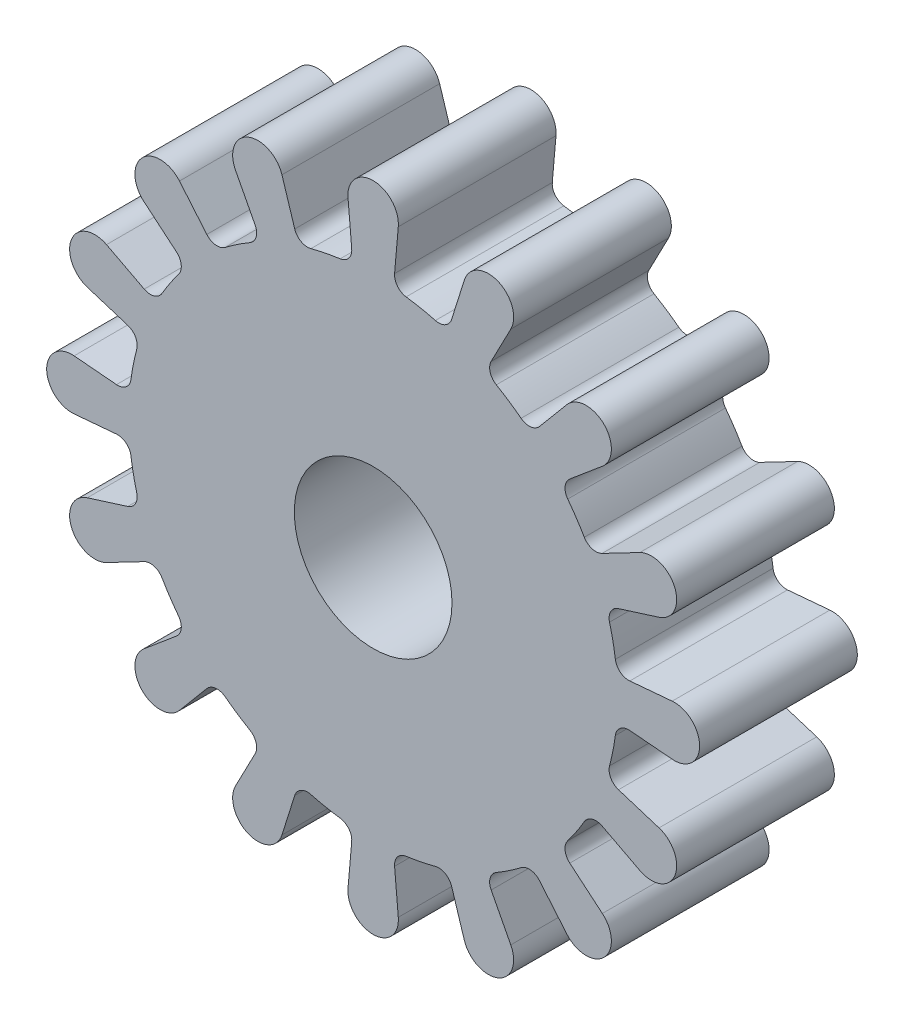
SolidWorks part; units mm, degrees
ref_plane "Спереди" through (0, 0, 0) normal (0, 0, 1) x (1, 0, 0)
ref_plane "Сверху" through (0, 0, 0) normal (0, 1, 0) x (1, 0, 0)
ref_plane "Справа" through (0, 0, 0) normal (1, 0, 0) x (0, 0, -1)
sketch "Эскиз1" plane through (0, 0, 0) normal (0, 0, 1) x (1, 0, 0)
  line L0 (0, 33.5216) -> (0, -33.5305) construction
  line L1 (-35.767, 0) -> (28.8712, 0) construction
  line L2 (-1.5939, 18.9606) -> (-1.3589, 16.2746)
  line L3 (1.5939, 18.9606) -> (1.3589, 16.2746)
  line L4 (5.7833, 18.1272) -> (4.9725, 15.5558)
  line L5 (8.7285, 16.9073) -> (7.4835, 14.5158)
  line L6 (12.2801, 14.5342) -> (10.547, 12.4688)
  line L7 (14.5342, 12.2801) -> (12.4688, 10.547)
  line L8 (16.9073, 8.7285) -> (14.5158, 7.4835)
  line L9 (18.1272, 5.7833) -> (15.5558, 4.9725)
  line L10 (18.9606, 1.5939) -> (16.2746, 1.3589)
  line L11 (18.9606, -1.5939) -> (16.2746, -1.3589)
  line L12 (18.1272, -5.7833) -> (15.5558, -4.9725)
  line L13 (16.9073, -8.7285) -> (14.5158, -7.4835)
  line L14 (14.5342, -12.2801) -> (12.4688, -10.547)
  line L15 (12.2801, -14.5342) -> (10.547, -12.4688)
  line L16 (8.7285, -16.9073) -> (7.4835, -14.5158)
  line L17 (5.7833, -18.1272) -> (4.9725, -15.5558)
  line L18 (1.5939, -18.9606) -> (1.3589, -16.2746)
  line L19 (-1.5939, -18.9606) -> (-1.3589, -16.2746)
  line L20 (-5.7833, -18.1272) -> (-4.9725, -15.5558)
  line L21 (-8.7285, -16.9073) -> (-7.4835, -14.5158)
  line L22 (-12.2801, -14.5342) -> (-10.547, -12.4688)
  line L23 (-14.5342, -12.2801) -> (-12.4688, -10.547)
  line L24 (-16.9073, -8.7285) -> (-14.5158, -7.4835)
  line L25 (-18.1272, -5.7833) -> (-15.5558, -4.9725)
  line L26 (-18.9606, -1.5939) -> (-16.2746, -1.3589)
  line L27 (-18.9606, 1.5939) -> (-16.2746, 1.3589)
  line L28 (-18.1272, 5.7833) -> (-15.5558, 4.9725)
  line L29 (-16.9073, 8.7285) -> (-14.5158, 7.4835)
  line L30 (-14.5342, 12.2801) -> (-12.4688, 10.547)
  line L31 (-12.2801, 14.5342) -> (-10.547, 12.4688)
  line L32 (-8.7285, 16.9073) -> (-7.4835, 14.5158)
  line L33 (-5.7833, 18.1272) -> (-4.9725, 15.5558)
  circle A0 centre (0, 0) radius 20.7 construction
  circle A1 centre (0, 0) radius 18.4 construction
  arc A2 (1.5939, 18.9606) -> (-1.5939, 18.9606) centre (0, 19.1) ccw
  arc A3 (8.7285, 16.9073) -> (5.7833, 18.1272) centre (7.3093, 17.6461) ccw
  arc A4 (14.5342, 12.2801) -> (12.2801, 14.5342) centre (13.5057, 13.5057) ccw
  arc A5 (18.1272, 5.7833) -> (16.9073, 8.7285) centre (17.6461, 7.3093) ccw
  arc A6 (18.9606, -1.5939) -> (18.9606, 1.5939) centre (19.1, 0) ccw
  arc A7 (16.9073, -8.7285) -> (18.1272, -5.7833) centre (17.6461, -7.3093) ccw
  arc A8 (12.2801, -14.5342) -> (14.5342, -12.2801) centre (13.5057, -13.5057) ccw
  arc A9 (5.7833, -18.1272) -> (8.7285, -16.9073) centre (7.3093, -17.6461) ccw
  arc A10 (-1.5939, -18.9606) -> (1.5939, -18.9606) centre (0, -19.1) ccw
  arc A11 (-8.7285, -16.9073) -> (-5.7833, -18.1272) centre (-7.3093, -17.6461) ccw
  arc A12 (-14.5342, -12.2801) -> (-12.2801, -14.5342) centre (-13.5057, -13.5057) ccw
  arc A13 (-18.1272, -5.7833) -> (-16.9073, -8.7285) centre (-17.6461, -7.3093) ccw
  arc A14 (-18.9606, 1.5939) -> (-18.9606, -1.5939) centre (-19.1, 0) ccw
  arc A15 (-16.9073, 8.7285) -> (-18.1272, 5.7833) centre (-17.6461, 7.3093) ccw
  arc A16 (-12.2801, 14.5342) -> (-14.5342, 12.2801) centre (-13.5057, 13.5057) ccw
  arc A17 (-5.7833, 18.1272) -> (-8.7285, 16.9073) centre (-7.3093, 17.6461) ccw
  circle A18 centre (0, 0) radius 0.0647
  arc A19 (-7.8092, 13.389) -> (-9.3814, 12.3385) centre (0, 0) ccw
  arc A20 (-2.091, 15.3583) -> (-3.9455, 14.9894) centre (0, 0) ccw
  arc A21 (3.9455, 14.9894) -> (2.091, 15.3583) centre (0, 0) ccw
  arc A22 (9.3814, 12.3385) -> (7.8092, 13.389) centre (0, 0) ccw
  arc A23 (13.389, 7.8092) -> (12.3385, 9.3814) centre (0, 0) ccw
  arc A24 (15.3583, 2.091) -> (14.9894, 3.9455) centre (0, 0) ccw
  arc A25 (14.9894, -3.9455) -> (15.3583, -2.091) centre (0, 0) ccw
  arc A26 (12.3385, -9.3814) -> (13.389, -7.8092) centre (0, 0) ccw
  arc A27 (7.8092, -13.389) -> (9.3814, -12.3385) centre (0, 0) ccw
  arc A28 (2.091, -15.3583) -> (3.9455, -14.9894) centre (0, 0) ccw
  arc A29 (-3.9455, -14.9894) -> (-2.091, -15.3583) centre (0, 0) ccw
  arc A30 (-9.3814, -12.3385) -> (-7.8092, -13.389) centre (0, 0) ccw
  arc A31 (-13.389, -7.8092) -> (-12.3385, -9.3814) centre (0, 0) ccw
  arc A32 (-15.3583, -2.091) -> (-14.9894, -3.9455) centre (0, 0) ccw
  arc A33 (-14.9894, 3.9455) -> (-15.3583, 2.091) centre (0, 0) ccw
  arc A34 (-12.3385, 9.3814) -> (-13.389, 7.8092) centre (0, 0) ccw
  arc A35 (7.8092, 13.389) -> (7.4835, 14.5158) centre (8.2375, 14.1233) cw
  arc A36 (10.547, 12.4688) -> (9.3814, 12.3385) centre (9.8959, 13.0152) cw
  arc A37 (12.3385, 9.3814) -> (12.4688, 10.547) centre (13.0152, 9.8959) cw
  arc A38 (14.5158, 7.4835) -> (13.389, 7.8092) centre (14.1233, 8.2375) cw
  arc A39 (15.5558, 4.9725) -> (14.9894, 3.9455) centre (15.8114, 4.1619) ccw
  arc A40 (16.2746, 1.3589) -> (15.3583, 2.091) centre (16.2005, 2.2057) cw
  arc A41 (15.3583, -2.091) -> (16.2746, -1.3589) centre (16.2005, -2.2057) cw
  arc A42 (14.9894, -3.9455) -> (15.5558, -4.9725) centre (15.8114, -4.1619) ccw
  arc A43 (13.389, -7.8092) -> (14.5158, -7.4835) centre (14.1233, -8.2375) cw
  arc A44 (12.4688, -10.547) -> (12.3385, -9.3814) centre (13.0152, -9.8959) cw
  arc A45 (10.547, -12.4688) -> (9.3814, -12.3385) centre (9.8959, -13.0152) ccw
  arc A46 (7.4835, -14.5158) -> (7.8092, -13.389) centre (8.2375, -14.1233) cw
  arc A47 (4.9725, -15.5558) -> (3.9455, -14.9894) centre (4.1619, -15.8114) ccw
  arc A48 (1.3589, -16.2746) -> (2.091, -15.3583) centre (2.2057, -16.2005) cw
  arc A49 (-1.3589, -16.2746) -> (-2.091, -15.3583) centre (-2.2057, -16.2005) ccw
  arc A50 (-3.9455, -14.9894) -> (-4.9725, -15.5558) centre (-4.1619, -15.8114) ccw
  arc A51 (-7.8092, -13.389) -> (-7.4835, -14.5158) centre (-8.2375, -14.1233) cw
  arc A52 (-9.3814, -12.3385) -> (-10.547, -12.4688) centre (-9.8959, -13.0152) ccw
  arc A53 (-12.3385, -9.3814) -> (-12.4688, -10.547) centre (-13.0152, -9.8959) cw
  arc A54 (-13.389, -7.8092) -> (-14.5158, -7.4835) centre (-14.1233, -8.2375) ccw
  arc A55 (-14.9894, -3.9455) -> (-15.5558, -4.9725) centre (-15.8114, -4.1619) cw
  arc A56 (-15.3583, -2.091) -> (-16.2746, -1.3589) centre (-16.2005, -2.2057) ccw
  arc A57 (-15.3583, 2.091) -> (-16.2746, 1.3589) centre (-16.2005, 2.2057) cw
  arc A58 (-14.9894, 3.9455) -> (-15.5558, 4.9725) centre (-15.8114, 4.1619) ccw
  arc A59 (-13.389, 7.8092) -> (-14.5158, 7.4835) centre (-14.1233, 8.2375) cw
  arc A60 (-12.4688, 10.547) -> (-12.3385, 9.3814) centre (-13.0152, 9.8959) cw
  arc A61 (-10.547, 12.4688) -> (-9.3814, 12.3385) centre (-9.8959, 13.0152) ccw
  arc A62 (-7.8092, 13.389) -> (-7.4835, 14.5158) centre (-8.2375, 14.1233) ccw
  arc A63 (4.9725, 15.5558) -> (3.9455, 14.9894) centre (4.1619, 15.8114) cw
  arc A64 (2.091, 15.3583) -> (1.3589, 16.2746) centre (2.2057, 16.2005) cw
  arc A65 (-1.3589, 16.2746) -> (-2.091, 15.3583) centre (-2.2057, 16.2005) cw
  arc A66 (-3.9455, 14.9894) -> (-4.9725, 15.5558) centre (-4.1619, 15.8114) cw
  circle A67 centre (0, 0) radius 5
  point P93 (10.0127, 11.832)
  point P98 (13.7784, 7.0997)
  point P103 (15.4465, 1.2865)
  point P112 (11.832, -10.0127)
  point P117 (7.0997, -13.7784)
  point P122 (1.2865, -15.4465)
  point P147 (-11.832, 10.0127)
  point P154 (4.7226, 14.763)
  point P159 (-1.2865, 15.4465)
  dimension "D1" = 41.4
  dimension "D2" = 36.8
  dimension "D3" = 3.2
  dimension "D6" = 31
  dimension "D7" = 0.85
  dimension "D8" = 10
  dimension "D4" = 10
  dimension "D5" = 16
extrude "Бобышка-Вытянуть1" add sketch "Эскиз1" along normal blind 10 contours A20 A66 L33 A17 L32 A62 A19 A61 L31 A16 L30 A60 A34 A59 L29 A15 L28 A58 A33 A57 L27 A14 L26 A56 A32 A55 L25 A13 L24 A54 A31 A53 L23 A12 L22 A52 A30 A51 L21 A11 L20 A50 A29 A49 L19 A10 L18 A48 A28 A47 L17
